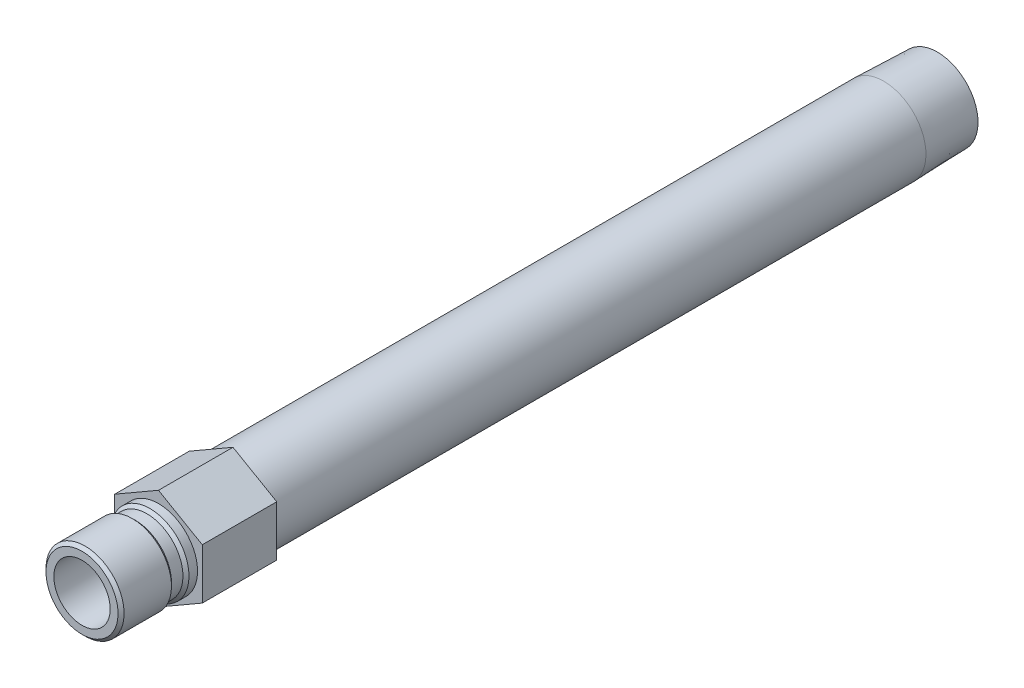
SolidWorks part; units mm, degrees
ref_plane "Front Plane" through (0, 0, 0) normal (0, 0, 1) x (1, 0, 0)
ref_plane "Top Plane" through (0, 0, 0) normal (0, 1, 0) x (1, 0, 0)
ref_plane "Right Plane" through (0, 0, 0) normal (1, 0, 0) x (0, 0, -1)
sketch "Sketch1" plane through (0, 0, 0) normal (1, 0, 0) x (0, 0, -1)
  line L0 (0, 0) -> (-22.479, 0) construction
  line L1 (-19.304, 7.112) -> (-19.304, 9.0932)
  line L2 (-5.8166, 9.0932) -> (-5.8166, 0) construction
  line L3 (-18.542, 9.8552) -> (-6.5786, 9.8552)
  line L4 (0, 10.668) -> (0, 0) construction
  line L5 (-5.8166, 9.0932) -> (-2.921, 9.0932)
  line L6 (-2.159, 9.8552) -> (0, 9.8552)
  line L7 (0, 9.8552) -> (0, 10.668)
  line L8 (-5.8166, 9.0932) -> (-6.5786, 9.8552)
  line L9 (-2.921, 9.0932) -> (-2.159, 9.8552)
  line L10 (-19.304, 9.0932) -> (-18.542, 9.8552)
  line L11 (-19.304, 7.112) -> (-1.524, 7.112)
  line L12 (0, 10.668) -> (183.0324, 10.668)
  line L13 (183.0324, 10.668) -> (196.596, 10.2441)
  line L14 (196.596, 10.2441) -> (196.596, 7.8994)
  line L15 (0, 9.8552) -> (18.796, 9.8552) construction
  line L16 (18.796, 9.8552) -> (18.796, 0) construction
  line L17 (18.796, 0) -> (0, 0) construction
  line L18 (-1.524, 7.112) -> (-1.1053, 7.8994)
  line L19 (-1.1053, 7.8994) -> (196.596, 7.8994)
  dimension "D1" = 19.304
  dimension "D2" = 2.8956
  dimension "D3" = 0.762
  dimension "D4" = 45
  dimension "D5" = 13.4874
  dimension "D6" = 45
  dimension "D7" = 1.79
  dimension "D8" = 13.5636
  dimension "D9" = 215.9
  dimension "D10" = 3.175
  dimension "D11" = 38.1
  dimension "D12" = 14.224
  dimension "D13" = 21.336
  dimension "D14" = 19.7104
  dimension "D15" = 15.7988
  dimension "D16" = 118
  dimension "D17" = 17.78
revolve "Revolve1" add sketch "Sketch1" angle 360 about L0
sketch "Sketch2" plane through (0, 0, 0) normal (0, 0, 1) x (1, 0, 0)
  line L1 (-11.049, 6.3791) -> (-11.049, -6.3791)
  line L2 (-11.049, -6.3791) -> (0, -12.7583)
  line L3 (0, -12.7583) -> (11.049, -6.3791)
  line L4 (11.049, -6.3791) -> (11.049, 6.3791)
  line L5 (11.049, 6.3791) -> (0, 12.7583)
  line L6 (0, 12.7583) -> (-11.049, 6.3791)
  circle A0 centre (0, 0) radius 11.049 construction
  circle A1 centre (0, 0) radius 7.112 construction
  circle A2 centre (0, 0) radius 7.112
  dimension "D1" = 22.098
extrude "Boss-Extrude1" add sketch "Sketch2" against normal up to vertex (18.796 mm away) from vertex at 0
